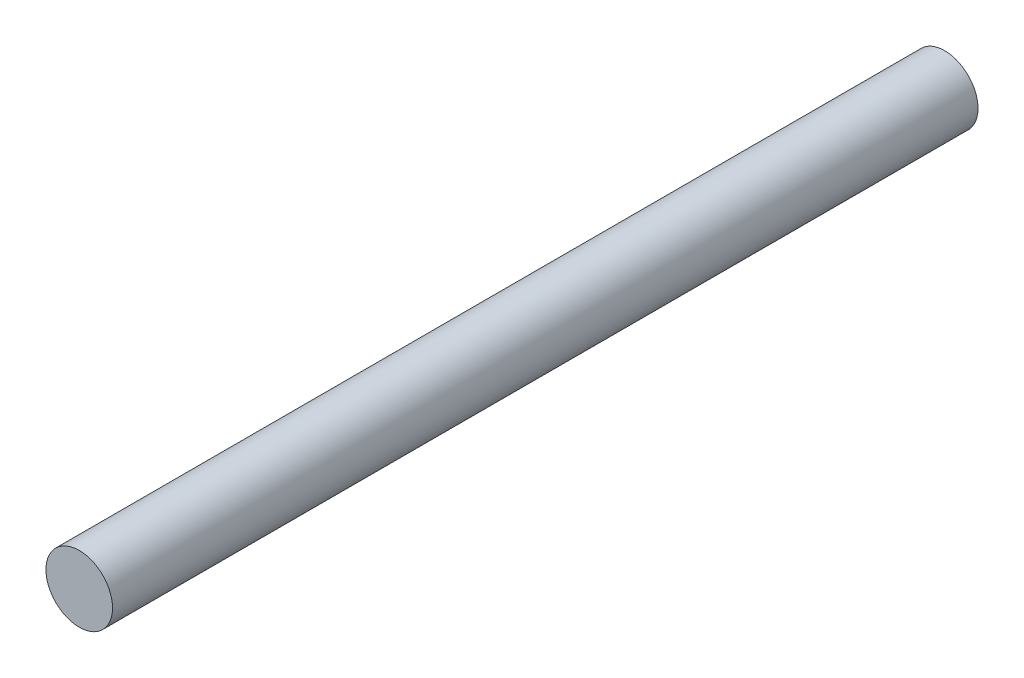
SolidWorks part; units mm, degrees
ref_plane "Front Plane" through (0, 0, 0) normal (0, 0, 1) x (1, 0, 0)
ref_plane "Top Plane" through (0, 0, 0) normal (0, 1, 0) x (1, 0, 0)
ref_plane "Right Plane" through (0, 0, 0) normal (1, 0, 0) x (0, 0, -1)
sketch "Sketch1" plane through (0, 0, 0) normal (0, 0, 1) x (1, 0, 0)
  circle A0 centre (0, 0) radius 2.5
  dimension "D1" = 5
extrude "Extrude1" add sketch "Sketch1" along normal blind 65
